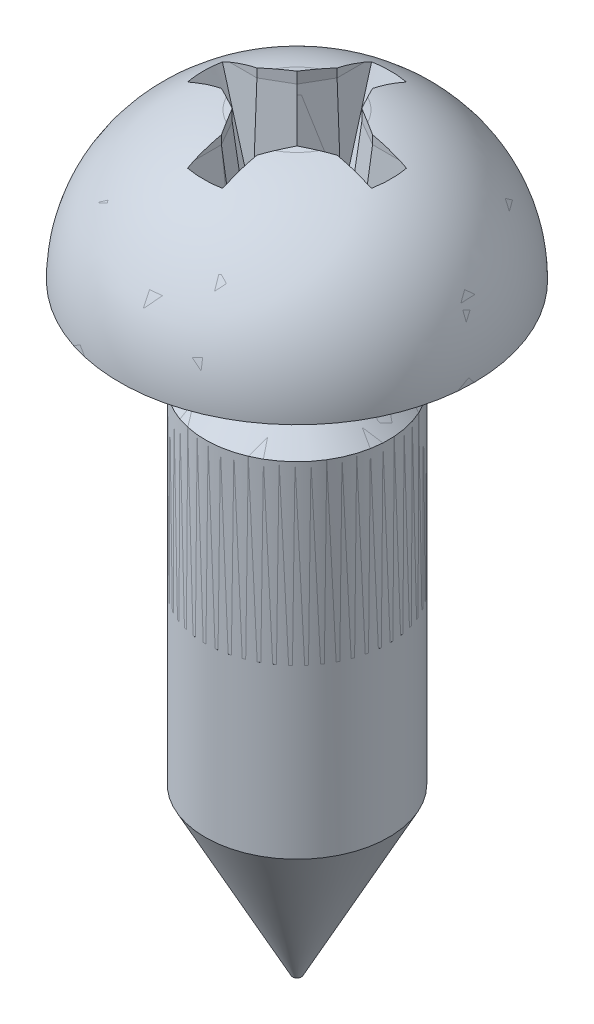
SolidWorks part; units mm, degrees
ref_plane "Plan1" through (0, 0, 0) normal (0, 0, 1) x (1, 0, 0)
ref_plane "Plan2" through (0, 0, 0) normal (0, 1, 0) x (1, 0, 0)
ref_plane "Plan3" through (0, 0, 0) normal (1, 0, 0) x (0, 0, -1)
imported_body "Importée1"
sketch "Esquisse2" plane through (0, 0, 0) normal (0, 0, 1) x (1, 0, 0)
  line L0 (-2.5674, -6.5) -> (3.4571, -6.5) construction
  line L2 (-2.2708, -6.5) -> (2.8454, -6.5)
  line L3 (-2.2708, -6.5) -> (-2.2708, -9.814)
  line L4 (-2.2708, -9.814) -> (2.8454, -9.814)
  line L5 (2.8454, -6.5) -> (2.8454, -9.814)
extrude "Enlèv. mat.-Extru.1" cut sketch "Esquisse2" against normal mid plane 10
chamfer "Chanfrein4" distance 1.3 angle 60
